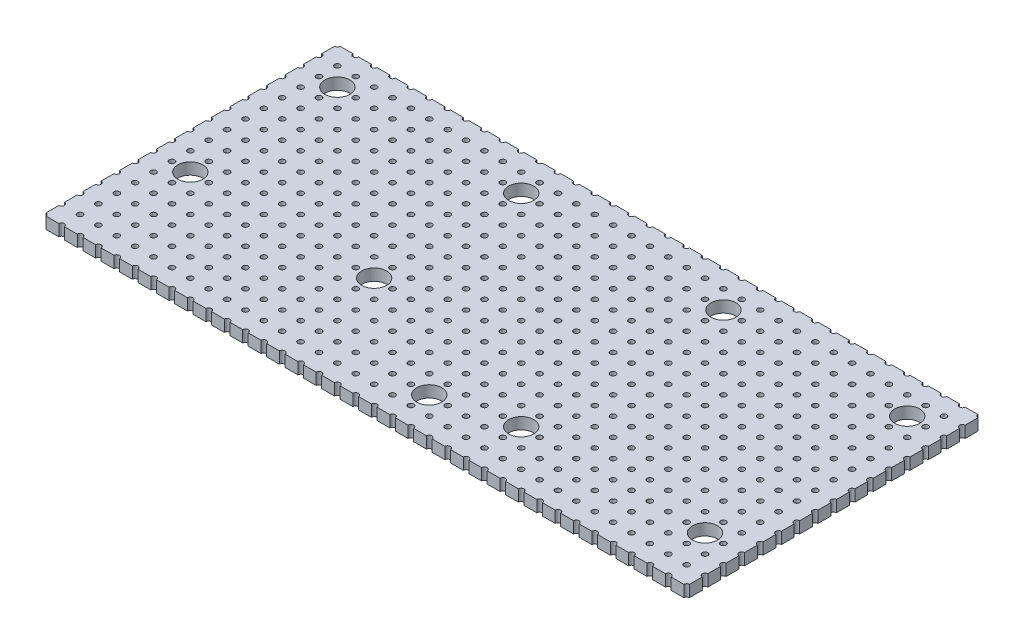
SolidWorks part; units mm, degrees
ref_plane "Front Plane" through (0, 0, 0) normal (0, 0, 1) x (1, 0, 0)
ref_plane "Top Plane" through (0, 0, 0) normal (0, 1, 0) x (1, 0, 0)
ref_plane "Right Plane" through (0, 0, 0) normal (1, 0, 0) x (0, 0, -1)
sketch "Sketch1" plane through (0, 0, 0) normal (0, 1, 0) x (1, 0, 0)
  line L1 (59.69, -39.37) -> (-59.69, -39.37)
  line L2 (59.69, -39.37) -> (59.69, 39.37)
  line L3 (59.69, 39.37) -> (-59.69, 39.37)
  line L4 (-59.69, -39.37) -> (-59.69, 39.37)
  line L5 (59.69, -39.37) -> (-59.69, 39.37) construction
  line L6 (59.69, 39.37) -> (-59.69, -39.37) construction
  point P0 (0, 0)
  dimension "D1" = 119.38
  dimension "D2" = 78.74
extrude "Boss-Extrude1" add sketch "Sketch1" along normal blind 1.6
sketch "Sketch2" plane through (0, 1.6, 0) normal (0, 1, 0) x (1, 0, 0)
  line L0 (-59.69, 39.37) -> (-59.69, -39.37) construction
  line L1 (59.69, 39.37) -> (-59.69, 39.37) construction
  circle A0 centre (-58.42, 38.1) radius 0.381
  circle A1 centre (-55.88, 38.1) radius 0.381
  circle A2 centre (-53.34, 38.1) radius 0.381
  circle A3 centre (-50.8, 38.1) radius 0.381
  circle A4 centre (-48.26, 38.1) radius 0.381
  circle A5 centre (-45.72, 38.1) radius 0.381
  circle A6 centre (-43.18, 38.1) radius 0.381
  circle A7 centre (-40.64, 38.1) radius 0.381
  circle A8 centre (-38.1, 38.1) radius 0.381
  circle A9 centre (-35.56, 38.1) radius 0.381
  circle A10 centre (-33.02, 38.1) radius 0.381
  circle A11 centre (-30.48, 38.1) radius 0.381
  circle A12 centre (-27.94, 38.1) radius 0.381
  circle A13 centre (-25.4, 38.1) radius 0.381
  circle A14 centre (-22.86, 38.1) radius 0.381
  circle A15 centre (-20.32, 38.1) radius 0.381
  circle A16 centre (-17.78, 38.1) radius 0.381
  circle A17 centre (-15.24, 38.1) radius 0.381
  circle A18 centre (-12.7, 38.1) radius 0.381
  circle A19 centre (-10.16, 38.1) radius 0.381
  circle A20 centre (-7.62, 38.1) radius 0.381
  circle A21 centre (-5.08, 38.1) radius 0.381
  circle A22 centre (-2.54, 38.1) radius 0.381
  circle A23 centre (0, 38.1) radius 0.381
  circle A24 centre (2.54, 38.1) radius 0.381
  circle A25 centre (5.08, 38.1) radius 0.381
  circle A26 centre (7.62, 38.1) radius 0.381
  circle A27 centre (10.16, 38.1) radius 0.381
  circle A28 centre (12.7, 38.1) radius 0.381
  circle A29 centre (15.24, 38.1) radius 0.381
  circle A30 centre (17.78, 38.1) radius 0.381
  circle A31 centre (20.32, 38.1) radius 0.381
  circle A32 centre (22.86, 38.1) radius 0.381
  circle A33 centre (25.4, 38.1) radius 0.381
  circle A34 centre (27.94, 38.1) radius 0.381
  circle A35 centre (30.48, 38.1) radius 0.381
  circle A36 centre (33.02, 38.1) radius 0.381
  circle A37 centre (35.56, 38.1) radius 0.381
  circle A38 centre (38.1, 38.1) radius 0.381
  circle A39 centre (40.64, 38.1) radius 0.381
  circle A40 centre (43.18, 38.1) radius 0.381
  circle A41 centre (45.72, 38.1) radius 0.381
  circle A42 centre (48.26, 38.1) radius 0.381
  circle A43 centre (50.8, 38.1) radius 0.381
  circle A44 centre (53.34, 38.1) radius 0.381
  circle A45 centre (55.88, 38.1) radius 0.381
  circle A46 centre (58.42, 38.1) radius 0.381
  circle A47 centre (-55.88, 35.56) radius 0.381
  circle A48 centre (-53.34, 35.56) radius 0.381
  circle A49 centre (-50.8, 35.56) radius 0.381
  circle A50 centre (-48.26, 35.56) radius 0.381
  circle A51 centre (-45.72, 35.56) radius 0.381
  circle A52 centre (-43.18, 35.56) radius 0.381
  circle A53 centre (-40.64, 35.56) radius 0.381
  circle A54 centre (-38.1, 35.56) radius 0.381
  circle A55 centre (-35.56, 35.56) radius 0.381
  circle A56 centre (-33.02, 35.56) radius 0.381
  circle A57 centre (-30.48, 35.56) radius 0.381
  circle A58 centre (-27.94, 35.56) radius 0.381
  circle A59 centre (-25.4, 35.56) radius 0.381
  circle A60 centre (-22.86, 35.56) radius 0.381
  circle A61 centre (-20.32, 35.56) radius 0.381
  circle A62 centre (-17.78, 35.56) radius 0.381
  circle A63 centre (-15.24, 35.56) radius 0.381
  circle A64 centre (-12.7, 35.56) radius 0.381
  circle A65 centre (-10.16, 35.56) radius 0.381
  circle A66 centre (-7.62, 35.56) radius 0.381
  circle A67 centre (-5.08, 35.56) radius 0.381
  circle A68 centre (-2.54, 35.56) radius 0.381
  circle A69 centre (0, 35.56) radius 0.381
  circle A70 centre (2.54, 35.56) radius 0.381
  circle A71 centre (5.08, 35.56) radius 0.381
  circle A72 centre (7.62, 35.56) radius 0.381
  circle A73 centre (10.16, 35.56) radius 0.381
  circle A74 centre (12.7, 35.56) radius 0.381
  circle A75 centre (15.24, 35.56) radius 0.381
  circle A76 centre (17.78, 35.56) radius 0.381
  circle A77 centre (20.32, 35.56) radius 0.381
  circle A78 centre (22.86, 35.56) radius 0.381
  circle A79 centre (25.4, 35.56) radius 0.381
  circle A80 centre (27.94, 35.56) radius 0.381
  circle A81 centre (30.48, 35.56) radius 0.381
  circle A82 centre (33.02, 35.56) radius 0.381
  circle A83 centre (35.56, 35.56) radius 0.381
  circle A84 centre (38.1, 35.56) radius 0.381
  circle A85 centre (40.64, 35.56) radius 0.381
  circle A86 centre (43.18, 35.56) radius 0.381
  circle A87 centre (45.72, 35.56) radius 0.381
  circle A88 centre (48.26, 35.56) radius 0.381
  circle A89 centre (50.8, 35.56) radius 0.381
  circle A90 centre (53.34, 35.56) radius 0.381
  circle A91 centre (55.88, 35.56) radius 0.381
  circle A92 centre (58.42, 35.56) radius 0.381
  circle A93 centre (-55.88, 33.02) radius 0.381
  circle A94 centre (-53.34, 33.02) radius 0.381
  circle A95 centre (-50.8, 33.02) radius 0.381
  circle A96 centre (-48.26, 33.02) radius 0.381
  circle A97 centre (-45.72, 33.02) radius 0.381
  circle A98 centre (-43.18, 33.02) radius 0.381
  circle A99 centre (-40.64, 33.02) radius 0.381
  circle A100 centre (-38.1, 33.02) radius 0.381
  circle A101 centre (-35.56, 33.02) radius 0.381
  circle A102 centre (-33.02, 33.02) radius 0.381
  circle A103 centre (-30.48, 33.02) radius 0.381
  circle A104 centre (-27.94, 33.02) radius 0.381
  circle A105 centre (-25.4, 33.02) radius 0.381
  circle A106 centre (-22.86, 33.02) radius 0.381
  circle A107 centre (-20.32, 33.02) radius 0.381
  circle A108 centre (-17.78, 33.02) radius 0.381
  circle A109 centre (-15.24, 33.02) radius 0.381
  circle A110 centre (-12.7, 33.02) radius 0.381
  circle A111 centre (-10.16, 33.02) radius 0.381
  circle A112 centre (-7.62, 33.02) radius 0.381
  circle A113 centre (-5.08, 33.02) radius 0.381
  circle A114 centre (-2.54, 33.02) radius 0.381
  circle A115 centre (0, 33.02) radius 0.381
  circle A116 centre (2.54, 33.02) radius 0.381
  circle A117 centre (5.08, 33.02) radius 0.381
  circle A118 centre (7.62, 33.02) radius 0.381
  circle A119 centre (10.16, 33.02) radius 0.381
  circle A120 centre (12.7, 33.02) radius 0.381
  circle A121 centre (15.24, 33.02) radius 0.381
  circle A122 centre (17.78, 33.02) radius 0.381
  circle A123 centre (20.32, 33.02) radius 0.381
  circle A124 centre (22.86, 33.02) radius 0.381
  circle A125 centre (25.4, 33.02) radius 0.381
  circle A126 centre (27.94, 33.02) radius 0.381
  circle A127 centre (30.48, 33.02) radius 0.381
  circle A128 centre (33.02, 33.02) radius 0.381
  circle A129 centre (35.56, 33.02) radius 0.381
  circle A130 centre (38.1, 33.02) radius 0.381
  circle A131 centre (40.64, 33.02) radius 0.381
  circle A132 centre (43.18, 33.02) radius 0.381
  circle A133 centre (45.72, 33.02) radius 0.381
  circle A134 centre (48.26, 33.02) radius 0.381
  circle A135 centre (50.8, 33.02) radius 0.381
  circle A136 centre (53.34, 33.02) radius 0.381
  circle A137 centre (55.88, 33.02) radius 0.381
  circle A138 centre (58.42, 33.02) radius 0.381
  circle A139 centre (-55.88, 30.48) radius 0.381
  circle A140 centre (-53.34, 30.48) radius 0.381
  circle A141 centre (-50.8, 30.48) radius 0.381
  circle A142 centre (-48.26, 30.48) radius 0.381
  circle A143 centre (-45.72, 30.48) radius 0.381
  circle A144 centre (-43.18, 30.48) radius 0.381
  circle A145 centre (-40.64, 30.48) radius 0.381
  circle A146 centre (-38.1, 30.48) radius 0.381
  circle A147 centre (-35.56, 30.48) radius 0.381
  circle A148 centre (-33.02, 30.48) radius 0.381
  circle A149 centre (-30.48, 30.48) radius 0.381
  circle A150 centre (-27.94, 30.48) radius 0.381
  circle A151 centre (-25.4, 30.48) radius 0.381
  circle A152 centre (-22.86, 30.48) radius 0.381
  circle A153 centre (-20.32, 30.48) radius 0.381
  circle A154 centre (-17.78, 30.48) radius 0.381
  circle A155 centre (-15.24, 30.48) radius 0.381
  circle A156 centre (-12.7, 30.48) radius 0.381
  circle A157 centre (-10.16, 30.48) radius 0.381
  circle A158 centre (-7.62, 30.48) radius 0.381
  circle A159 centre (-5.08, 30.48) radius 0.381
  circle A160 centre (-2.54, 30.48) radius 0.381
  circle A161 centre (0, 30.48) radius 0.381
  circle A162 centre (2.54, 30.48) radius 0.381
  circle A163 centre (5.08, 30.48) radius 0.381
  circle A164 centre (7.62, 30.48) radius 0.381
  circle A165 centre (10.16, 30.48) radius 0.381
  circle A166 centre (12.7, 30.48) radius 0.381
  circle A167 centre (15.24, 30.48) radius 0.381
  circle A168 centre (17.78, 30.48) radius 0.381
  circle A169 centre (20.32, 30.48) radius 0.381
  circle A170 centre (22.86, 30.48) radius 0.381
  circle A171 centre (25.4, 30.48) radius 0.381
  circle A172 centre (27.94, 30.48) radius 0.381
  circle A173 centre (30.48, 30.48) radius 0.381
  circle A174 centre (33.02, 30.48) radius 0.381
  circle A175 centre (35.56, 30.48) radius 0.381
  circle A176 centre (38.1, 30.48) radius 0.381
  circle A177 centre (40.64, 30.48) radius 0.381
  circle A178 centre (43.18, 30.48) radius 0.381
  circle A179 centre (45.72, 30.48) radius 0.381
  circle A180 centre (48.26, 30.48) radius 0.381
  circle A181 centre (50.8, 30.48) radius 0.381
  circle A182 centre (53.34, 30.48) radius 0.381
  circle A183 centre (55.88, 30.48) radius 0.381
  circle A184 centre (58.42, 30.48) radius 0.381
  circle A185 centre (-55.88, 27.94) radius 0.381
  circle A186 centre (-53.34, 27.94) radius 0.381
  circle A187 centre (-50.8, 27.94) radius 0.381
  circle A188 centre (-48.26, 27.94) radius 0.381
  circle A189 centre (-45.72, 27.94) radius 0.381
  circle A190 centre (-43.18, 27.94) radius 0.381
  circle A191 centre (-40.64, 27.94) radius 0.381
  circle A192 centre (-38.1, 27.94) radius 0.381
  circle A193 centre (-35.56, 27.94) radius 0.381
  circle A194 centre (-33.02, 27.94) radius 0.381
  circle A195 centre (-30.48, 27.94) radius 0.381
  circle A196 centre (-27.94, 27.94) radius 0.381
  circle A197 centre (-25.4, 27.94) radius 0.381
  circle A198 centre (-22.86, 27.94) radius 0.381
  circle A199 centre (-20.32, 27.94) radius 0.381
  circle A200 centre (-17.78, 27.94) radius 0.381
  circle A201 centre (-15.24, 27.94) radius 0.381
  circle A202 centre (-12.7, 27.94) radius 0.381
  circle A203 centre (-10.16, 27.94) radius 0.381
  circle A204 centre (-7.62, 27.94) radius 0.381
  circle A205 centre (-5.08, 27.94) radius 0.381
  circle A206 centre (-2.54, 27.94) radius 0.381
  circle A207 centre (0, 27.94) radius 0.381
  circle A208 centre (2.54, 27.94) radius 0.381
  circle A209 centre (5.08, 27.94) radius 0.381
  circle A210 centre (7.62, 27.94) radius 0.381
  circle A211 centre (10.16, 27.94) radius 0.381
  circle A212 centre (12.7, 27.94) radius 0.381
  circle A213 centre (15.24, 27.94) radius 0.381
  circle A214 centre (17.78, 27.94) radius 0.381
  circle A215 centre (20.32, 27.94) radius 0.381
  circle A216 centre (22.86, 27.94) radius 0.381
  circle A217 centre (25.4, 27.94) radius 0.381
  circle A218 centre (27.94, 27.94) radius 0.381
  circle A219 centre (30.48, 27.94) radius 0.381
  circle A220 centre (33.02, 27.94) radius 0.381
  circle A221 centre (35.56, 27.94) radius 0.381
  circle A222 centre (38.1, 27.94) radius 0.381
  circle A223 centre (40.64, 27.94) radius 0.381
  circle A224 centre (43.18, 27.94) radius 0.381
  circle A225 centre (45.72, 27.94) radius 0.381
  circle A226 centre (48.26, 27.94) radius 0.381
  circle A227 centre (50.8, 27.94) radius 0.381
  circle A228 centre (53.34, 27.94) radius 0.381
  circle A229 centre (55.88, 27.94) radius 0.381
  circle A230 centre (58.42, 27.94) radius 0.381
  circle A231 centre (-55.88, 25.4) radius 0.381
  circle A232 centre (-53.34, 25.4) radius 0.381
  circle A233 centre (-50.8, 25.4) radius 0.381
  circle A234 centre (-48.26, 25.4) radius 0.381
  circle A235 centre (-45.72, 25.4) radius 0.381
  circle A236 centre (-43.18, 25.4) radius 0.381
  circle A237 centre (-40.64, 25.4) radius 0.381
  circle A238 centre (-38.1, 25.4) radius 0.381
  circle A239 centre (-35.56, 25.4) radius 0.381
  circle A240 centre (-33.02, 25.4) radius 0.381
  circle A241 centre (-30.48, 25.4) radius 0.381
  circle A242 centre (-27.94, 25.4) radius 0.381
  circle A243 centre (-25.4, 25.4) radius 0.381
  circle A244 centre (-22.86, 25.4) radius 0.381
  circle A245 centre (-20.32, 25.4) radius 0.381
  circle A246 centre (-17.78, 25.4) radius 0.381
  circle A247 centre (-15.24, 25.4) radius 0.381
  circle A248 centre (-12.7, 25.4) radius 0.381
  circle A249 centre (-10.16, 25.4) radius 0.381
  circle A250 centre (-7.62, 25.4) radius 0.381
  circle A251 centre (-5.08, 25.4) radius 0.381
  circle A252 centre (-2.54, 25.4) radius 0.381
  circle A253 centre (0, 25.4) radius 0.381
  circle A254 centre (2.54, 25.4) radius 0.381
  circle A255 centre (5.08, 25.4) radius 0.381
  circle A256 centre (7.62, 25.4) radius 0.381
  circle A257 centre (10.16, 25.4) radius 0.381
  circle A258 centre (12.7, 25.4) radius 0.381
  circle A259 centre (15.24, 25.4) radius 0.381
  circle A260 centre (17.78, 25.4) radius 0.381
  circle A261 centre (20.32, 25.4) radius 0.381
  circle A262 centre (22.86, 25.4) radius 0.381
  circle A263 centre (25.4, 25.4) radius 0.381
  circle A264 centre (27.94, 25.4) radius 0.381
  circle A265 centre (30.48, 25.4) radius 0.381
  circle A266 centre (33.02, 25.4) radius 0.381
  circle A267 centre (35.56, 25.4) radius 0.381
  circle A268 centre (38.1, 25.4) radius 0.381
  circle A269 centre (40.64, 25.4) radius 0.381
  circle A270 centre (43.18, 25.4) radius 0.381
  circle A271 centre (45.72, 25.4) radius 0.381
  circle A272 centre (48.26, 25.4) radius 0.381
  circle A273 centre (50.8, 25.4) radius 0.381
  circle A274 centre (53.34, 25.4) radius 0.381
  circle A275 centre (55.88, 25.4) radius 0.381
  circle A276 centre (58.42, 25.4) radius 0.381
  circle A277 centre (-55.88, 22.86) radius 0.381
  circle A278 centre (-53.34, 22.86) radius 0.381
  circle A279 centre (-50.8, 22.86) radius 0.381
  circle A280 centre (-48.26, 22.86) radius 0.381
  circle A281 centre (-45.72, 22.86) radius 0.381
  circle A282 centre (-43.18, 22.86) radius 0.381
  circle A283 centre (-40.64, 22.86) radius 0.381
  circle A284 centre (-38.1, 22.86) radius 0.381
  circle A285 centre (-35.56, 22.86) radius 0.381
  circle A286 centre (-33.02, 22.86) radius 0.381
  circle A287 centre (-30.48, 22.86) radius 0.381
  circle A288 centre (-27.94, 22.86) radius 0.381
  circle A289 centre (-25.4, 22.86) radius 0.381
  circle A290 centre (-22.86, 22.86) radius 0.381
  circle A291 centre (-20.32, 22.86) radius 0.381
  circle A292 centre (-17.78, 22.86) radius 0.381
  circle A293 centre (-15.24, 22.86) radius 0.381
  circle A294 centre (-12.7, 22.86) radius 0.381
  circle A295 centre (-10.16, 22.86) radius 0.381
  circle A296 centre (-7.62, 22.86) radius 0.381
  circle A297 centre (-5.08, 22.86) radius 0.381
  circle A298 centre (-2.54, 22.86) radius 0.381
  circle A299 centre (0, 22.86) radius 0.381
  circle A300 centre (2.54, 22.86) radius 0.381
  circle A301 centre (5.08, 22.86) radius 0.381
  circle A302 centre (7.62, 22.86) radius 0.381
  circle A303 centre (10.16, 22.86) radius 0.381
  circle A304 centre (12.7, 22.86) radius 0.381
  circle A305 centre (15.24, 22.86) radius 0.381
  circle A306 centre (17.78, 22.86) radius 0.381
  circle A307 centre (20.32, 22.86) radius 0.381
  circle A308 centre (22.86, 22.86) radius 0.381
  circle A309 centre (25.4, 22.86) radius 0.381
  circle A310 centre (27.94, 22.86) radius 0.381
  circle A311 centre (30.48, 22.86) radius 0.381
  circle A312 centre (33.02, 22.86) radius 0.381
  circle A313 centre (35.56, 22.86) radius 0.381
  circle A314 centre (38.1, 22.86) radius 0.381
  circle A315 centre (40.64, 22.86) radius 0.381
  circle A316 centre (43.18, 22.86) radius 0.381
  circle A317 centre (45.72, 22.86) radius 0.381
  circle A318 centre (48.26, 22.86) radius 0.381
  circle A319 centre (50.8, 22.86) radius 0.381
  circle A320 centre (53.34, 22.86) radius 0.381
  circle A321 centre (55.88, 22.86) radius 0.381
  circle A322 centre (58.42, 22.86) radius 0.381
  circle A323 centre (-55.88, 20.32) radius 0.381
  circle A324 centre (-53.34, 20.32) radius 0.381
  circle A325 centre (-50.8, 20.32) radius 0.381
  circle A326 centre (-48.26, 20.32) radius 0.381
  circle A327 centre (-45.72, 20.32) radius 0.381
  circle A328 centre (-43.18, 20.32) radius 0.381
  circle A329 centre (-40.64, 20.32) radius 0.381
  circle A330 centre (-38.1, 20.32) radius 0.381
  circle A331 centre (-35.56, 20.32) radius 0.381
  circle A332 centre (-33.02, 20.32) radius 0.381
  circle A333 centre (-30.48, 20.32) radius 0.381
  circle A334 centre (-27.94, 20.32) radius 0.381
  circle A335 centre (-25.4, 20.32) radius 0.381
  circle A336 centre (-22.86, 20.32) radius 0.381
  circle A337 centre (-20.32, 20.32) radius 0.381
  circle A338 centre (-17.78, 20.32) radius 0.381
  circle A339 centre (-15.24, 20.32) radius 0.381
  circle A340 centre (-12.7, 20.32) radius 0.381
  circle A341 centre (-10.16, 20.32) radius 0.381
  circle A342 centre (-7.62, 20.32) radius 0.381
  circle A343 centre (-5.08, 20.32) radius 0.381
  circle A344 centre (-2.54, 20.32) radius 0.381
  circle A345 centre (0, 20.32) radius 0.381
  circle A346 centre (2.54, 20.32) radius 0.381
  circle A347 centre (5.08, 20.32) radius 0.381
  circle A348 centre (7.62, 20.32) radius 0.381
  circle A349 centre (10.16, 20.32) radius 0.381
  circle A350 centre (12.7, 20.32) radius 0.381
  circle A351 centre (15.24, 20.32) radius 0.381
  circle A352 centre (17.78, 20.32) radius 0.381
  circle A353 centre (20.32, 20.32) radius 0.381
  circle A354 centre (22.86, 20.32) radius 0.381
  circle A355 centre (25.4, 20.32) radius 0.381
  circle A356 centre (27.94, 20.32) radius 0.381
  circle A357 centre (30.48, 20.32) radius 0.381
  circle A358 centre (33.02, 20.32) radius 0.381
  circle A359 centre (35.56, 20.32) radius 0.381
  circle A360 centre (38.1, 20.32) radius 0.381
  circle A361 centre (40.64, 20.32) radius 0.381
  circle A362 centre (43.18, 20.32) radius 0.381
  circle A363 centre (45.72, 20.32) radius 0.381
  circle A364 centre (48.26, 20.32) radius 0.381
  circle A365 centre (50.8, 20.32) radius 0.381
  circle A366 centre (53.34, 20.32) radius 0.381
  circle A367 centre (55.88, 20.32) radius 0.381
  circle A368 centre (58.42, 20.32) radius 0.381
  circle A369 centre (-55.88, 17.78) radius 0.381
  circle A370 centre (-53.34, 17.78) radius 0.381
  circle A371 centre (-50.8, 17.78) radius 0.381
  circle A372 centre (-48.26, 17.78) radius 0.381
  circle A373 centre (-45.72, 17.78) radius 0.381
  circle A374 centre (-43.18, 17.78) radius 0.381
  circle A375 centre (-40.64, 17.78) radius 0.381
  circle A376 centre (-38.1, 17.78) radius 0.381
  circle A377 centre (-35.56, 17.78) radius 0.381
  circle A378 centre (-33.02, 17.78) radius 0.381
  circle A379 centre (-30.48, 17.78) radius 0.381
  circle A380 centre (-27.94, 17.78) radius 0.381
  circle A381 centre (-25.4, 17.78) radius 0.381
  circle A382 centre (-22.86, 17.78) radius 0.381
  circle A383 centre (-20.32, 17.78) radius 0.381
  circle A384 centre (-17.78, 17.78) radius 0.381
  circle A385 centre (-15.24, 17.78) radius 0.381
  circle A386 centre (-12.7, 17.78) radius 0.381
  circle A387 centre (-10.16, 17.78) radius 0.381
  circle A388 centre (-7.62, 17.78) radius 0.381
  circle A389 centre (-5.08, 17.78) radius 0.381
  circle A390 centre (-2.54, 17.78) radius 0.381
  circle A391 centre (0, 17.78) radius 0.381
  circle A392 centre (2.54, 17.78) radius 0.381
  circle A393 centre (5.08, 17.78) radius 0.381
  circle A394 centre (7.62, 17.78) radius 0.381
  circle A395 centre (10.16, 17.78) radius 0.381
  circle A396 centre (12.7, 17.78) radius 0.381
  circle A397 centre (15.24, 17.78) radius 0.381
  circle A398 centre (17.78, 17.78) radius 0.381
  circle A399 centre (20.32, 17.78) radius 0.381
  circle A400 centre (22.86, 17.78) radius 0.381
  circle A401 centre (25.4, 17.78) radius 0.381
  circle A402 centre (27.94, 17.78) radius 0.381
  circle A403 centre (30.48, 17.78) radius 0.381
  circle A404 centre (33.02, 17.78) radius 0.381
  circle A405 centre (35.56, 17.78) radius 0.381
  circle A406 centre (38.1, 17.78) radius 0.381
  circle A407 centre (40.64, 17.78) radius 0.381
  circle A408 centre (43.18, 17.78) radius 0.381
  circle A409 centre (45.72, 17.78) radius 0.381
  circle A410 centre (48.26, 17.78) radius 0.381
  circle A411 centre (50.8, 17.78) radius 0.381
  circle A412 centre (53.34, 17.78) radius 0.381
  circle A413 centre (55.88, 17.78) radius 0.381
  circle A414 centre (58.42, 17.78) radius 0.381
  circle A415 centre (-55.88, 15.24) radius 0.381
  circle A416 centre (-53.34, 15.24) radius 0.381
  circle A417 centre (-50.8, 15.24) radius 0.381
  circle A418 centre (-48.26, 15.24) radius 0.381
  circle A419 centre (-45.72, 15.24) radius 0.381
  circle A420 centre (-43.18, 15.24) radius 0.381
  circle A421 centre (-40.64, 15.24) radius 0.381
  circle A422 centre (-38.1, 15.24) radius 0.381
  circle A423 centre (-35.56, 15.24) radius 0.381
  circle A424 centre (-33.02, 15.24) radius 0.381
  circle A425 centre (-30.48, 15.24) radius 0.381
  circle A426 centre (-27.94, 15.24) radius 0.381
  circle A427 centre (-25.4, 15.24) radius 0.381
  circle A428 centre (-22.86, 15.24) radius 0.381
  circle A429 centre (-20.32, 15.24) radius 0.381
  circle A430 centre (-17.78, 15.24) radius 0.381
  circle A431 centre (-15.24, 15.24) radius 0.381
  circle A432 centre (-12.7, 15.24) radius 0.381
  circle A433 centre (-10.16, 15.24) radius 0.381
  circle A434 centre (-7.62, 15.24) radius 0.381
  circle A435 centre (-5.08, 15.24) radius 0.381
  circle A436 centre (-2.54, 15.24) radius 0.381
  circle A437 centre (0, 15.24) radius 0.381
  circle A438 centre (2.54, 15.24) radius 0.381
  circle A439 centre (5.08, 15.24) radius 0.381
  circle A440 centre (7.62, 15.24) radius 0.381
  circle A441 centre (10.16, 15.24) radius 0.381
  circle A442 centre (12.7, 15.24) radius 0.381
  circle A443 centre (15.24, 15.24) radius 0.381
  circle A444 centre (17.78, 15.24) radius 0.381
  circle A445 centre (20.32, 15.24) radius 0.381
  circle A446 centre (22.86, 15.24) radius 0.381
  circle A447 centre (25.4, 15.24) radius 0.381
  circle A448 centre (27.94, 15.24) radius 0.381
  circle A449 centre (30.48, 15.24) radius 0.381
  circle A450 centre (33.02, 15.24) radius 0.381
  circle A451 centre (35.56, 15.24) radius 0.381
  circle A452 centre (38.1, 15.24) radius 0.381
  circle A453 centre (40.64, 15.24) radius 0.381
  circle A454 centre (43.18, 15.24) radius 0.381
  circle A455 centre (45.72, 15.24) radius 0.381
  circle A456 centre (48.26, 15.24) radius 0.381
  circle A457 centre (50.8, 15.24) radius 0.381
  circle A458 centre (53.34, 15.24) radius 0.381
  circle A459 centre (55.88, 15.24) radius 0.381
  circle A460 centre (58.42, 15.24) radius 0.381
  circle A461 centre (-55.88, 12.7) radius 0.381
  circle A462 centre (-53.34, 12.7) radius 0.381
  circle A463 centre (-50.8, 12.7) radius 0.381
  circle A464 centre (-48.26, 12.7) radius 0.381
  circle A465 centre (-45.72, 12.7) radius 0.381
  circle A466 centre (-43.18, 12.7) radius 0.381
  circle A467 centre (-40.64, 12.7) radius 0.381
  circle A468 centre (-38.1, 12.7) radius 0.381
  circle A469 centre (-35.56, 12.7) radius 0.381
  circle A470 centre (-33.02, 12.7) radius 0.381
  circle A471 centre (-30.48, 12.7) radius 0.381
  circle A472 centre (-27.94, 12.7) radius 0.381
  circle A473 centre (-25.4, 12.7) radius 0.381
  circle A474 centre (-22.86, 12.7) radius 0.381
  circle A475 centre (-20.32, 12.7) radius 0.381
  circle A476 centre (-17.78, 12.7) radius 0.381
  circle A477 centre (-15.24, 12.7) radius 0.381
  circle A478 centre (-12.7, 12.7) radius 0.381
  circle A479 centre (-10.16, 12.7) radius 0.381
  circle A480 centre (-7.62, 12.7) radius 0.381
  circle A481 centre (-5.08, 12.7) radius 0.381
  circle A482 centre (-2.54, 12.7) radius 0.381
  circle A483 centre (0, 12.7) radius 0.381
  circle A484 centre (2.54, 12.7) radius 0.381
  circle A485 centre (5.08, 12.7) radius 0.381
  circle A486 centre (7.62, 12.7) radius 0.381
  circle A487 centre (10.16, 12.7) radius 0.381
  circle A488 centre (12.7, 12.7) radius 0.381
  circle A489 centre (15.24, 12.7) radius 0.381
  circle A490 centre (17.78, 12.7) radius 0.381
  circle A491 centre (20.32, 12.7) radius 0.381
  circle A492 centre (22.86, 12.7) radius 0.381
  circle A493 centre (25.4, 12.7) radius 0.381
  circle A494 centre (27.94, 12.7) radius 0.381
  circle A495 centre (30.48, 12.7) radius 0.381
  circle A496 centre (33.02, 12.7) radius 0.381
  circle A497 centre (35.56, 12.7) radius 0.381
  circle A498 centre (38.1, 12.7) radius 0.381
  circle A499 centre (40.64, 12.7) radius 0.381
  circle A500 centre (43.18, 12.7) radius 0.381
  circle A501 centre (45.72, 12.7) radius 0.381
  circle A502 centre (48.26, 12.7) radius 0.381
  circle A503 centre (50.8, 12.7) radius 0.381
  circle A504 centre (53.34, 12.7) radius 0.381
  circle A505 centre (55.88, 12.7) radius 0.381
  circle A506 centre (58.42, 12.7) radius 0.381
  circle A507 centre (-55.88, 10.16) radius 0.381
  circle A508 centre (-53.34, 10.16) radius 0.381
  circle A509 centre (-50.8, 10.16) radius 0.381
  circle A510 centre (-48.26, 10.16) radius 0.381
  circle A511 centre (-45.72, 10.16) radius 0.381
  circle A512 centre (-43.18, 10.16) radius 0.381
  circle A513 centre (-40.64, 10.16) radius 0.381
  circle A514 centre (-38.1, 10.16) radius 0.381
  circle A515 centre (-35.56, 10.16) radius 0.381
  circle A516 centre (-33.02, 10.16) radius 0.381
  circle A517 centre (-30.48, 10.16) radius 0.381
  circle A518 centre (-27.94, 10.16) radius 0.381
  circle A519 centre (-25.4, 10.16) radius 0.381
  circle A520 centre (-22.86, 10.16) radius 0.381
  circle A521 centre (-20.32, 10.16) radius 0.381
  circle A522 centre (-17.78, 10.16) radius 0.381
  circle A523 centre (-15.24, 10.16) radius 0.381
  circle A524 centre (-12.7, 10.16) radius 0.381
  circle A525 centre (-10.16, 10.16) radius 0.381
  circle A526 centre (-7.62, 10.16) radius 0.381
  circle A527 centre (-5.08, 10.16) radius 0.381
  circle A528 centre (-2.54, 10.16) radius 0.381
  circle A529 centre (0, 10.16) radius 0.381
  circle A530 centre (2.54, 10.16) radius 0.381
  circle A531 centre (5.08, 10.16) radius 0.381
  circle A532 centre (7.62, 10.16) radius 0.381
  circle A533 centre (10.16, 10.16) radius 0.381
  circle A534 centre (12.7, 10.16) radius 0.381
  circle A535 centre (15.24, 10.16) radius 0.381
  circle A536 centre (17.78, 10.16) radius 0.381
  circle A537 centre (20.32, 10.16) radius 0.381
  circle A538 centre (22.86, 10.16) radius 0.381
  circle A539 centre (25.4, 10.16) radius 0.381
  circle A540 centre (27.94, 10.16) radius 0.381
  circle A541 centre (30.48, 10.16) radius 0.381
  circle A542 centre (33.02, 10.16) radius 0.381
  circle A543 centre (35.56, 10.16) radius 0.381
  circle A544 centre (38.1, 10.16) radius 0.381
  circle A545 centre (40.64, 10.16) radius 0.381
  circle A546 centre (43.18, 10.16) radius 0.381
  circle A547 centre (45.72, 10.16) radius 0.381
  circle A548 centre (48.26, 10.16) radius 0.381
  circle A549 centre (50.8, 10.16) radius 0.381
  circle A550 centre (53.34, 10.16) radius 0.381
  circle A551 centre (55.88, 10.16) radius 0.381
  circle A552 centre (58.42, 10.16) radius 0.381
  circle A553 centre (-55.88, 7.62) radius 0.381
  circle A554 centre (-53.34, 7.62) radius 0.381
  circle A555 centre (-50.8, 7.62) radius 0.381
  circle A556 centre (-48.26, 7.62) radius 0.381
  circle A557 centre (-45.72, 7.62) radius 0.381
  circle A558 centre (-43.18, 7.62) radius 0.381
  circle A559 centre (-40.64, 7.62) radius 0.381
  circle A560 centre (-38.1, 7.62) radius 0.381
  circle A561 centre (-35.56, 7.62) radius 0.381
  circle A562 centre (-33.02, 7.62) radius 0.381
  circle A563 centre (-30.48, 7.62) radius 0.381
  circle A564 centre (-27.94, 7.62) radius 0.381
  circle A565 centre (-25.4, 7.62) radius 0.381
  circle A566 centre (-22.86, 7.62) radius 0.381
  circle A567 centre (-20.32, 7.62) radius 0.381
  circle A568 centre (-17.78, 7.62) radius 0.381
  circle A569 centre (-15.24, 7.62) radius 0.381
  circle A570 centre (-12.7, 7.62) radius 0.381
  circle A571 centre (-10.16, 7.62) radius 0.381
  circle A572 centre (-7.62, 7.62) radius 0.381
  circle A573 centre (-5.08, 7.62) radius 0.381
  circle A574 centre (-2.54, 7.62) radius 0.381
  circle A575 centre (0, 7.62) radius 0.381
  circle A576 centre (2.54, 7.62) radius 0.381
  circle A577 centre (5.08, 7.62) radius 0.381
  circle A578 centre (7.62, 7.62) radius 0.381
  circle A579 centre (10.16, 7.62) radius 0.381
  circle A580 centre (12.7, 7.62) radius 0.381
  circle A581 centre (15.24, 7.62) radius 0.381
  circle A582 centre (17.78, 7.62) radius 0.381
  circle A583 centre (20.32, 7.62) radius 0.381
  circle A584 centre (22.86, 7.62) radius 0.381
  circle A585 centre (25.4, 7.62) radius 0.381
  circle A586 centre (27.94, 7.62) radius 0.381
  circle A587 centre (30.48, 7.62) radius 0.381
  circle A588 centre (33.02, 7.62) radius 0.381
  circle A589 centre (35.56, 7.62) radius 0.381
  circle A590 centre (38.1, 7.62) radius 0.381
  circle A591 centre (40.64, 7.62) radius 0.381
  circle A592 centre (43.18, 7.62) radius 0.381
  circle A593 centre (45.72, 7.62) radius 0.381
  circle A594 centre (48.26, 7.62) radius 0.381
  circle A595 centre (50.8, 7.62) radius 0.381
  circle A596 centre (53.34, 7.62) radius 0.381
  circle A597 centre (55.88, 7.62) radius 0.381
  circle A598 centre (58.42, 7.62) radius 0.381
  circle A599 centre (-55.88, 5.08) radius 0.381
  circle A600 centre (-53.34, 5.08) radius 0.381
  circle A601 centre (-50.8, 5.08) radius 0.381
  circle A602 centre (-48.26, 5.08) radius 0.381
  circle A603 centre (-45.72, 5.08) radius 0.381
  circle A604 centre (-43.18, 5.08) radius 0.381
  circle A605 centre (-40.64, 5.08) radius 0.381
  circle A606 centre (-38.1, 5.08) radius 0.381
  circle A607 centre (-35.56, 5.08) radius 0.381
  circle A608 centre (-33.02, 5.08) radius 0.381
  circle A609 centre (-30.48, 5.08) radius 0.381
  circle A610 centre (-27.94, 5.08) radius 0.381
  circle A611 centre (-25.4, 5.08) radius 0.381
  circle A612 centre (-22.86, 5.08) radius 0.381
  circle A613 centre (-20.32, 5.08) radius 0.381
  circle A614 centre (-17.78, 5.08) radius 0.381
  circle A615 centre (-15.24, 5.08) radius 0.381
  circle A616 centre (-12.7, 5.08) radius 0.381
  circle A617 centre (-10.16, 5.08) radius 0.381
  circle A618 centre (-7.62, 5.08) radius 0.381
  circle A619 centre (-5.08, 5.08) radius 0.381
  circle A620 centre (-2.54, 5.08) radius 0.381
  circle A621 centre (0, 5.08) radius 0.381
  circle A622 centre (2.54, 5.08) radius 0.381
  circle A623 centre (5.08, 5.08) radius 0.381
  circle A624 centre (7.62, 5.08) radius 0.381
  circle A625 centre (10.16, 5.08) radius 0.381
  circle A626 centre (12.7, 5.08) radius 0.381
  circle A627 centre (15.24, 5.08) radius 0.381
  circle A628 centre (17.78, 5.08) radius 0.381
  circle A629 centre (20.32, 5.08) radius 0.381
  circle A630 centre (22.86, 5.08) radius 0.381
  circle A631 centre (25.4, 5.08) radius 0.381
  circle A632 centre (27.94, 5.08) radius 0.381
  circle A633 centre (30.48, 5.08) radius 0.381
  circle A634 centre (33.02, 5.08) radius 0.381
  circle A635 centre (35.56, 5.08) radius 0.381
  circle A636 centre (38.1, 5.08) radius 0.381
  circle A637 centre (40.64, 5.08) radius 0.381
  circle A638 centre (43.18, 5.08) radius 0.381
  circle A639 centre (45.72, 5.08) radius 0.381
  circle A640 centre (48.26, 5.08) radius 0.381
  circle A641 centre (50.8, 5.08) radius 0.381
  circle A642 centre (53.34, 5.08) radius 0.381
  circle A643 centre (55.88, 5.08) radius 0.381
  circle A644 centre (58.42, 5.08) radius 0.381
  circle A645 centre (-55.88, 2.54) radius 0.381
  circle A646 centre (-53.34, 2.54) radius 0.381
  circle A647 centre (-50.8, 2.54) radius 0.381
  circle A648 centre (-48.26, 2.54) radius 0.381
  circle A649 centre (-45.72, 2.54) radius 0.381
  circle A650 centre (-43.18, 2.54) radius 0.381
  circle A651 centre (-40.64, 2.54) radius 0.381
  circle A652 centre (-38.1, 2.54) radius 0.381
  circle A653 centre (-35.56, 2.54) radius 0.381
  circle A654 centre (-33.02, 2.54) radius 0.381
  circle A655 centre (-30.48, 2.54) radius 0.381
  circle A656 centre (-27.94, 2.54) radius 0.381
  circle A657 centre (-25.4, 2.54) radius 0.381
  circle A658 centre (-22.86, 2.54) radius 0.381
  circle A659 centre (-20.32, 2.54) radius 0.381
  circle A660 centre (-17.78, 2.54) radius 0.381
  circle A661 centre (-15.24, 2.54) radius 0.381
  circle A662 centre (-12.7, 2.54) radius 0.381
  circle A663 centre (-10.16, 2.54) radius 0.381
  circle A664 centre (-7.62, 2.54) radius 0.381
  circle A665 centre (-5.08, 2.54) radius 0.381
  circle A666 centre (-2.54, 2.54) radius 0.381
  circle A667 centre (0, 2.54) radius 0.381
  circle A668 centre (2.54, 2.54) radius 0.381
  circle A669 centre (5.08, 2.54) radius 0.381
  circle A670 centre (7.62, 2.54) radius 0.381
  circle A671 centre (10.16, 2.54) radius 0.381
  circle A672 centre (12.7, 2.54) radius 0.381
  circle A673 centre (15.24, 2.54) radius 0.381
  circle A674 centre (17.78, 2.54) radius 0.381
  circle A675 centre (20.32, 2.54) radius 0.381
  circle A676 centre (22.86, 2.54) radius 0.381
  circle A677 centre (25.4, 2.54) radius 0.381
  circle A678 centre (27.94, 2.54) radius 0.381
  circle A679 centre (30.48, 2.54) radius 0.381
  circle A680 centre (33.02, 2.54) radius 0.381
  circle A681 centre (35.56, 2.54) radius 0.381
  circle A682 centre (38.1, 2.54) radius 0.381
  circle A683 centre (40.64, 2.54) radius 0.381
  circle A684 centre (43.18, 2.54) radius 0.381
  circle A685 centre (45.72, 2.54) radius 0.381
  circle A686 centre (48.26, 2.54) radius 0.381
  circle A687 centre (50.8, 2.54) radius 0.381
  circle A688 centre (53.34, 2.54) radius 0.381
  circle A689 centre (55.88, 2.54) radius 0.381
  circle A690 centre (58.42, 2.54) radius 0.381
  circle A691 centre (-55.88, 0) radius 0.381
  circle A692 centre (-53.34, 0) radius 0.381
  circle A693 centre (-50.8, 0) radius 0.381
  circle A694 centre (-48.26, 0) radius 0.381
  circle A695 centre (-45.72, 0) radius 0.381
  circle A696 centre (-43.18, 0) radius 0.381
  circle A697 centre (-40.64, 0) radius 0.381
  circle A698 centre (-38.1, 0) radius 0.381
  circle A699 centre (-35.56, 0) radius 0.381
  circle A700 centre (-33.02, 0) radius 0.381
  circle A701 centre (-30.48, 0) radius 0.381
  circle A702 centre (-27.94, 0) radius 0.381
  circle A703 centre (-25.4, 0) radius 0.381
  circle A704 centre (-22.86, 0) radius 0.381
  circle A705 centre (-20.32, 0) radius 0.381
  circle A706 centre (-17.78, 0) radius 0.381
  circle A707 centre (-15.24, 0) radius 0.381
  circle A708 centre (-12.7, 0) radius 0.381
  circle A709 centre (-10.16, 0) radius 0.381
  circle A710 centre (-7.62, 0) radius 0.381
  circle A711 centre (-5.08, 0) radius 0.381
  circle A712 centre (-2.54, 0) radius 0.381
  circle A713 centre (0, 0) radius 0.381
  circle A714 centre (2.54, 0) radius 0.381
  circle A715 centre (5.08, 0) radius 0.381
  circle A716 centre (7.62, 0) radius 0.381
  circle A717 centre (10.16, 0) radius 0.381
  circle A718 centre (12.7, 0) radius 0.381
  circle A719 centre (15.24, 0) radius 0.381
  circle A720 centre (17.78, 0) radius 0.381
  circle A721 centre (20.32, 0) radius 0.381
  circle A722 centre (22.86, 0) radius 0.381
  circle A723 centre (25.4, 0) radius 0.381
  circle A724 centre (27.94, 0) radius 0.381
  circle A725 centre (30.48, 0) radius 0.381
  circle A726 centre (33.02, 0) radius 0.381
  circle A727 centre (35.56, 0) radius 0.381
  circle A728 centre (38.1, 0) radius 0.381
  circle A729 centre (40.64, 0) radius 0.381
  circle A730 centre (43.18, 0) radius 0.381
  circle A731 centre (45.72, 0) radius 0.381
  circle A732 centre (48.26, 0) radius 0.381
  circle A733 centre (50.8, 0) radius 0.381
  circle A734 centre (53.34, 0) radius 0.381
  circle A735 centre (55.88, 0) radius 0.381
  circle A736 centre (58.42, 0) radius 0.381
  circle A737 centre (-55.88, -2.54) radius 0.381
  circle A738 centre (-53.34, -2.54) radius 0.381
  circle A739 centre (-50.8, -2.54) radius 0.381
  circle A740 centre (-48.26, -2.54) radius 0.381
  circle A741 centre (-45.72, -2.54) radius 0.381
  circle A742 centre (-43.18, -2.54) radius 0.381
  circle A743 centre (-40.64, -2.54) radius 0.381
  circle A744 centre (-38.1, -2.54) radius 0.381
  circle A745 centre (-35.56, -2.54) radius 0.381
  circle A746 centre (-33.02, -2.54) radius 0.381
  circle A747 centre (-30.48, -2.54) radius 0.381
  circle A748 centre (-27.94, -2.54) radius 0.381
  circle A749 centre (-25.4, -2.54) radius 0.381
  circle A750 centre (-22.86, -2.54) radius 0.381
  circle A751 centre (-20.32, -2.54) radius 0.381
  circle A752 centre (-17.78, -2.54) radius 0.381
  circle A753 centre (-15.24, -2.54) radius 0.381
  circle A754 centre (-12.7, -2.54) radius 0.381
  circle A755 centre (-10.16, -2.54) radius 0.381
  circle A756 centre (-7.62, -2.54) radius 0.381
  circle A757 centre (-5.08, -2.54) radius 0.381
  circle A758 centre (-2.54, -2.54) radius 0.381
  circle A759 centre (0, -2.54) radius 0.381
  circle A760 centre (2.54, -2.54) radius 0.381
  circle A761 centre (5.08, -2.54) radius 0.381
  circle A762 centre (7.62, -2.54) radius 0.381
  circle A763 centre (10.16, -2.54) radius 0.381
  circle A764 centre (12.7, -2.54) radius 0.381
  circle A765 centre (15.24, -2.54) radius 0.381
  circle A766 centre (17.78, -2.54) radius 0.381
  circle A767 centre (20.32, -2.54) radius 0.381
  circle A768 centre (22.86, -2.54) radius 0.381
  circle A769 centre (25.4, -2.54) radius 0.381
  circle A770 centre (27.94, -2.54) radius 0.381
  circle A771 centre (30.48, -2.54) radius 0.381
  circle A772 centre (33.02, -2.54) radius 0.381
  circle A773 centre (35.56, -2.54) radius 0.381
  circle A774 centre (38.1, -2.54) radius 0.381
  circle A775 centre (40.64, -2.54) radius 0.381
  circle A776 centre (43.18, -2.54) radius 0.381
  circle A777 centre (45.72, -2.54) radius 0.381
  circle A778 centre (48.26, -2.54) radius 0.381
  circle A779 centre (50.8, -2.54) radius 0.381
  circle A780 centre (53.34, -2.54) radius 0.381
  circle A781 centre (55.88, -2.54) radius 0.381
  circle A782 centre (58.42, -2.54) radius 0.381
  circle A783 centre (-55.88, -5.08) radius 0.381
  circle A784 centre (-53.34, -5.08) radius 0.381
  circle A785 centre (-50.8, -5.08) radius 0.381
  circle A786 centre (-48.26, -5.08) radius 0.381
  circle A787 centre (-45.72, -5.08) radius 0.381
  circle A788 centre (-43.18, -5.08) radius 0.381
  circle A789 centre (-40.64, -5.08) radius 0.381
  circle A790 centre (-38.1, -5.08) radius 0.381
  circle A791 centre (-35.56, -5.08) radius 0.381
  circle A792 centre (-33.02, -5.08) radius 0.381
  circle A793 centre (-30.48, -5.08) radius 0.381
  circle A794 centre (-27.94, -5.08) radius 0.381
  circle A795 centre (-25.4, -5.08) radius 0.381
  circle A796 centre (-22.86, -5.08) radius 0.381
  circle A797 centre (-20.32, -5.08) radius 0.381
  circle A798 centre (-17.78, -5.08) radius 0.381
  circle A799 centre (-15.24, -5.08) radius 0.381
  circle A800 centre (-12.7, -5.08) radius 0.381
  circle A801 centre (-10.16, -5.08) radius 0.381
  circle A802 centre (-7.62, -5.08) radius 0.381
  circle A803 centre (-5.08, -5.08) radius 0.381
  circle A804 centre (-2.54, -5.08) radius 0.381
  circle A805 centre (0, -5.08) radius 0.381
  circle A806 centre (2.54, -5.08) radius 0.381
  circle A807 centre (5.08, -5.08) radius 0.381
  circle A808 centre (7.62, -5.08) radius 0.381
  circle A809 centre (10.16, -5.08) radius 0.381
  circle A810 centre (12.7, -5.08) radius 0.381
  circle A811 centre (15.24, -5.08) radius 0.381
  circle A812 centre (17.78, -5.08) radius 0.381
  circle A813 centre (20.32, -5.08) radius 0.381
  circle A814 centre (22.86, -5.08) radius 0.381
  circle A815 centre (25.4, -5.08) radius 0.381
  circle A816 centre (27.94, -5.08) radius 0.381
  circle A817 centre (30.48, -5.08) radius 0.381
  circle A818 centre (33.02, -5.08) radius 0.381
  circle A819 centre (35.56, -5.08) radius 0.381
  circle A820 centre (38.1, -5.08) radius 0.381
  circle A821 centre (40.64, -5.08) radius 0.381
  circle A822 centre (43.18, -5.08) radius 0.381
  circle A823 centre (45.72, -5.08) radius 0.381
  circle A824 centre (48.26, -5.08) radius 0.381
  circle A825 centre (50.8, -5.08) radius 0.381
  circle A826 centre (53.34, -5.08) radius 0.381
  circle A827 centre (55.88, -5.08) radius 0.381
  circle A828 centre (58.42, -5.08) radius 0.381
  circle A829 centre (-55.88, -7.62) radius 0.381
  circle A830 centre (-53.34, -7.62) radius 0.381
  circle A831 centre (-50.8, -7.62) radius 0.381
  circle A832 centre (-48.26, -7.62) radius 0.381
  circle A833 centre (-45.72, -7.62) radius 0.381
  circle A834 centre (-43.18, -7.62) radius 0.381
  circle A835 centre (-40.64, -7.62) radius 0.381
  circle A836 centre (-38.1, -7.62) radius 0.381
  circle A837 centre (-35.56, -7.62) radius 0.381
  circle A838 centre (-33.02, -7.62) radius 0.381
  circle A839 centre (-30.48, -7.62) radius 0.381
  circle A840 centre (-27.94, -7.62) radius 0.381
  circle A841 centre (-25.4, -7.62) radius 0.381
  circle A842 centre (-22.86, -7.62) radius 0.381
  circle A843 centre (-20.32, -7.62) radius 0.381
  circle A844 centre (-17.78, -7.62) radius 0.381
  circle A845 centre (-15.24, -7.62) radius 0.381
  circle A846 centre (-12.7, -7.62) radius 0.381
  circle A847 centre (-10.16, -7.62) radius 0.381
  circle A848 centre (-7.62, -7.62) radius 0.381
  circle A849 centre (-5.08, -7.62) radius 0.381
  circle A850 centre (-2.54, -7.62) radius 0.381
  circle A851 centre (0, -7.62) radius 0.381
  circle A852 centre (2.54, -7.62) radius 0.381
  circle A853 centre (5.08, -7.62) radius 0.381
  circle A854 centre (7.62, -7.62) radius 0.381
  circle A855 centre (10.16, -7.62) radius 0.381
  circle A856 centre (12.7, -7.62) radius 0.381
  circle A857 centre (15.24, -7.62) radius 0.381
  circle A858 centre (17.78, -7.62) radius 0.381
  circle A859 centre (20.32, -7.62) radius 0.381
  circle A860 centre (22.86, -7.62) radius 0.381
  circle A861 centre (25.4, -7.62) radius 0.381
  circle A862 centre (27.94, -7.62) radius 0.381
  circle A863 centre (30.48, -7.62) radius 0.381
  circle A864 centre (33.02, -7.62) radius 0.381
  circle A865 centre (35.56, -7.62) radius 0.381
  circle A866 centre (38.1, -7.62) radius 0.381
  circle A867 centre (40.64, -7.62) radius 0.381
  circle A868 centre (43.18, -7.62) radius 0.381
  circle A869 centre (45.72, -7.62) radius 0.381
  circle A870 centre (48.26, -7.62) radius 0.381
  circle A871 centre (50.8, -7.62) radius 0.381
  circle A872 centre (53.34, -7.62) radius 0.381
  circle A873 centre (55.88, -7.62) radius 0.381
  circle A874 centre (58.42, -7.62) radius 0.381
  circle A875 centre (-55.88, -10.16) radius 0.381
  circle A876 centre (-53.34, -10.16) radius 0.381
  circle A877 centre (-50.8, -10.16) radius 0.381
  circle A878 centre (-48.26, -10.16) radius 0.381
  circle A879 centre (-45.72, -10.16) radius 0.381
  circle A880 centre (-43.18, -10.16) radius 0.381
  circle A881 centre (-40.64, -10.16) radius 0.381
  circle A882 centre (-38.1, -10.16) radius 0.381
  circle A883 centre (-35.56, -10.16) radius 0.381
  circle A884 centre (-33.02, -10.16) radius 0.381
  circle A885 centre (-30.48, -10.16) radius 0.381
  circle A886 centre (-27.94, -10.16) radius 0.381
  circle A887 centre (-25.4, -10.16) radius 0.381
  circle A888 centre (-22.86, -10.16) radius 0.381
  circle A889 centre (-20.32, -10.16) radius 0.381
  circle A890 centre (-17.78, -10.16) radius 0.381
  circle A891 centre (-15.24, -10.16) radius 0.381
  circle A892 centre (-12.7, -10.16) radius 0.381
  circle A893 centre (-10.16, -10.16) radius 0.381
  circle A894 centre (-7.62, -10.16) radius 0.381
  circle A895 centre (-5.08, -10.16) radius 0.381
  circle A896 centre (-2.54, -10.16) radius 0.381
  circle A897 centre (0, -10.16) radius 0.381
  circle A898 centre (2.54, -10.16) radius 0.381
  circle A899 centre (5.08, -10.16) radius 0.381
  circle A900 centre (7.62, -10.16) radius 0.381
  circle A901 centre (10.16, -10.16) radius 0.381
  circle A902 centre (12.7, -10.16) radius 0.381
  circle A903 centre (15.24, -10.16) radius 0.381
  circle A904 centre (17.78, -10.16) radius 0.381
  circle A905 centre (20.32, -10.16) radius 0.381
  circle A906 centre (22.86, -10.16) radius 0.381
  circle A907 centre (25.4, -10.16) radius 0.381
  circle A908 centre (27.94, -10.16) radius 0.381
  circle A909 centre (30.48, -10.16) radius 0.381
  circle A910 centre (33.02, -10.16) radius 0.381
  circle A911 centre (35.56, -10.16) radius 0.381
  circle A912 centre (38.1, -10.16) radius 0.381
  circle A913 centre (40.64, -10.16) radius 0.381
  circle A914 centre (43.18, -10.16) radius 0.381
  circle A915 centre (45.72, -10.16) radius 0.381
  circle A916 centre (48.26, -10.16) radius 0.381
  circle A917 centre (50.8, -10.16) radius 0.381
  circle A918 centre (53.34, -10.16) radius 0.381
  circle A919 centre (55.88, -10.16) radius 0.381
  circle A920 centre (58.42, -10.16) radius 0.381
  circle A921 centre (-55.88, -12.7) radius 0.381
  circle A922 centre (-53.34, -12.7) radius 0.381
  circle A923 centre (-50.8, -12.7) radius 0.381
  circle A924 centre (-48.26, -12.7) radius 0.381
  circle A925 centre (-45.72, -12.7) radius 0.381
  circle A926 centre (-43.18, -12.7) radius 0.381
  circle A927 centre (-40.64, -12.7) radius 0.381
  circle A928 centre (-38.1, -12.7) radius 0.381
  circle A929 centre (-35.56, -12.7) radius 0.381
  circle A930 centre (-33.02, -12.7) radius 0.381
  circle A931 centre (-30.48, -12.7) radius 0.381
  circle A932 centre (-27.94, -12.7) radius 0.381
  circle A933 centre (-25.4, -12.7) radius 0.381
  circle A934 centre (-22.86, -12.7) radius 0.381
  circle A935 centre (-20.32, -12.7) radius 0.381
  circle A936 centre (-17.78, -12.7) radius 0.381
  circle A937 centre (-15.24, -12.7) radius 0.381
  circle A938 centre (-12.7, -12.7) radius 0.381
  circle A939 centre (-10.16, -12.7) radius 0.381
  circle A940 centre (-7.62, -12.7) radius 0.381
  circle A941 centre (-5.08, -12.7) radius 0.381
  circle A942 centre (-2.54, -12.7) radius 0.381
  circle A943 centre (0, -12.7) radius 0.381
  circle A944 centre (2.54, -12.7) radius 0.381
  circle A945 centre (5.08, -12.7) radius 0.381
  circle A946 centre (7.62, -12.7) radius 0.381
  circle A947 centre (10.16, -12.7) radius 0.381
  circle A948 centre (12.7, -12.7) radius 0.381
  circle A949 centre (15.24, -12.7) radius 0.381
  circle A950 centre (17.78, -12.7) radius 0.381
  circle A951 centre (20.32, -12.7) radius 0.381
  circle A952 centre (22.86, -12.7) radius 0.381
  circle A953 centre (25.4, -12.7) radius 0.381
  circle A954 centre (27.94, -12.7) radius 0.381
  circle A955 centre (30.48, -12.7) radius 0.381
  circle A956 centre (33.02, -12.7) radius 0.381
  circle A957 centre (35.56, -12.7) radius 0.381
  circle A958 centre (38.1, -12.7) radius 0.381
  circle A959 centre (40.64, -12.7) radius 0.381
  circle A960 centre (43.18, -12.7) radius 0.381
  circle A961 centre (45.72, -12.7) radius 0.381
  circle A962 centre (48.26, -12.7) radius 0.381
  circle A963 centre (50.8, -12.7) radius 0.381
  circle A964 centre (53.34, -12.7) radius 0.381
  circle A965 centre (55.88, -12.7) radius 0.381
  circle A966 centre (58.42, -12.7) radius 0.381
  circle A967 centre (-55.88, -15.24) radius 0.381
  circle A968 centre (-53.34, -15.24) radius 0.381
  circle A969 centre (-50.8, -15.24) radius 0.381
  circle A970 centre (-48.26, -15.24) radius 0.381
  circle A971 centre (-45.72, -15.24) radius 0.381
  circle A972 centre (-43.18, -15.24) radius 0.381
  circle A973 centre (-40.64, -15.24) radius 0.381
  circle A974 centre (-38.1, -15.24) radius 0.381
  circle A975 centre (-35.56, -15.24) radius 0.381
  circle A976 centre (-33.02, -15.24) radius 0.381
  circle A977 centre (-30.48, -15.24) radius 0.381
  circle A978 centre (-27.94, -15.24) radius 0.381
  circle A979 centre (-25.4, -15.24) radius 0.381
  circle A980 centre (-22.86, -15.24) radius 0.381
  circle A981 centre (-20.32, -15.24) radius 0.381
  circle A982 centre (-17.78, -15.24) radius 0.381
  circle A983 centre (-15.24, -15.24) radius 0.381
  circle A984 centre (-12.7, -15.24) radius 0.381
  circle A985 centre (-10.16, -15.24) radius 0.381
  circle A986 centre (-7.62, -15.24) radius 0.381
  circle A987 centre (-5.08, -15.24) radius 0.381
  circle A988 centre (-2.54, -15.24) radius 0.381
  circle A989 centre (0, -15.24) radius 0.381
  circle A990 centre (2.54, -15.24) radius 0.381
  circle A991 centre (5.08, -15.24) radius 0.381
  circle A992 centre (7.62, -15.24) radius 0.381
  circle A993 centre (10.16, -15.24) radius 0.381
  circle A994 centre (12.7, -15.24) radius 0.381
  circle A995 centre (15.24, -15.24) radius 0.381
  circle A996 centre (17.78, -15.24) radius 0.381
  circle A997 centre (20.32, -15.24) radius 0.381
  circle A998 centre (22.86, -15.24) radius 0.381
  circle A999 centre (25.4, -15.24) radius 0.381
  circle A1000 centre (27.94, -15.24) radius 0.381
  circle A1001 centre (30.48, -15.24) radius 0.381
  circle A1002 centre (33.02, -15.24) radius 0.381
  circle A1003 centre (35.56, -15.24) radius 0.381
  circle A1004 centre (38.1, -15.24) radius 0.381
  circle A1005 centre (40.64, -15.24) radius 0.381
  circle A1006 centre (43.18, -15.24) radius 0.381
  circle A1007 centre (45.72, -15.24) radius 0.381
  circle A1008 centre (48.26, -15.24) radius 0.381
  circle A1009 centre (50.8, -15.24) radius 0.381
  circle A1010 centre (53.34, -15.24) radius 0.381
  circle A1011 centre (55.88, -15.24) radius 0.381
  circle A1012 centre (58.42, -15.24) radius 0.381
  circle A1013 centre (-55.88, -17.78) radius 0.381
  circle A1014 centre (-53.34, -17.78) radius 0.381
  circle A1015 centre (-50.8, -17.78) radius 0.381
  circle A1016 centre (-48.26, -17.78) radius 0.381
  circle A1017 centre (-45.72, -17.78) radius 0.381
  circle A1018 centre (-43.18, -17.78) radius 0.381
  circle A1019 centre (-40.64, -17.78) radius 0.381
  circle A1020 centre (-38.1, -17.78) radius 0.381
  circle A1021 centre (-35.56, -17.78) radius 0.381
  circle A1022 centre (-33.02, -17.78) radius 0.381
  circle A1023 centre (-30.48, -17.78) radius 0.381
  circle A1024 centre (-27.94, -17.78) radius 0.381
  circle A1025 centre (-25.4, -17.78) radius 0.381
  circle A1026 centre (-22.86, -17.78) radius 0.381
  circle A1027 centre (-20.32, -17.78) radius 0.381
  circle A1028 centre (-17.78, -17.78) radius 0.381
  circle A1029 centre (-15.24, -17.78) radius 0.381
  circle A1030 centre (-12.7, -17.78) radius 0.381
  circle A1031 centre (-10.16, -17.78) radius 0.381
  circle A1032 centre (-7.62, -17.78) radius 0.381
  circle A1033 centre (-5.08, -17.78) radius 0.381
  circle A1034 centre (-2.54, -17.78) radius 0.381
  circle A1035 centre (0, -17.78) radius 0.381
  circle A1036 centre (2.54, -17.78) radius 0.381
  circle A1037 centre (5.08, -17.78) radius 0.381
  circle A1038 centre (7.62, -17.78) radius 0.381
  circle A1039 centre (10.16, -17.78) radius 0.381
  circle A1040 centre (12.7, -17.78) radius 0.381
  circle A1041 centre (15.24, -17.78) radius 0.381
  circle A1042 centre (17.78, -17.78) radius 0.381
  circle A1043 centre (20.32, -17.78) radius 0.381
  circle A1044 centre (22.86, -17.78) radius 0.381
  circle A1045 centre (25.4, -17.78) radius 0.381
  circle A1046 centre (27.94, -17.78) radius 0.381
  circle A1047 centre (30.48, -17.78) radius 0.381
  circle A1048 centre (33.02, -17.78) radius 0.381
  circle A1049 centre (35.56, -17.78) radius 0.381
  circle A1050 centre (38.1, -17.78) radius 0.381
  circle A1051 centre (40.64, -17.78) radius 0.381
  circle A1052 centre (43.18, -17.78) radius 0.381
  circle A1053 centre (45.72, -17.78) radius 0.381
  circle A1054 centre (48.26, -17.78) radius 0.381
  circle A1055 centre (50.8, -17.78) radius 0.381
  circle A1056 centre (53.34, -17.78) radius 0.381
  circle A1057 centre (55.88, -17.78) radius 0.381
  circle A1058 centre (58.42, -17.78) radius 0.381
  circle A1059 centre (-55.88, -20.32) radius 0.381
  circle A1060 centre (-53.34, -20.32) radius 0.381
  circle A1061 centre (-50.8, -20.32) radius 0.381
  circle A1062 centre (-48.26, -20.32) radius 0.381
  circle A1063 centre (-45.72, -20.32) radius 0.381
  circle A1064 centre (-43.18, -20.32) radius 0.381
  circle A1065 centre (-40.64, -20.32) radius 0.381
  circle A1066 centre (-38.1, -20.32) radius 0.381
  circle A1067 centre (-35.56, -20.32) radius 0.381
  circle A1068 centre (-33.02, -20.32) radius 0.381
  circle A1069 centre (-30.48, -20.32) radius 0.381
  circle A1070 centre (-27.94, -20.32) radius 0.381
  circle A1071 centre (-25.4, -20.32) radius 0.381
  circle A1072 centre (-22.86, -20.32) radius 0.381
  circle A1073 centre (-20.32, -20.32) radius 0.381
  circle A1074 centre (-17.78, -20.32) radius 0.381
  circle A1075 centre (-15.24, -20.32) radius 0.381
  circle A1076 centre (-12.7, -20.32) radius 0.381
  circle A1077 centre (-10.16, -20.32) radius 0.381
  circle A1078 centre (-7.62, -20.32) radius 0.381
  circle A1079 centre (-5.08, -20.32) radius 0.381
  circle A1080 centre (-2.54, -20.32) radius 0.381
  circle A1081 centre (0, -20.32) radius 0.381
  circle A1082 centre (2.54, -20.32) radius 0.381
  circle A1083 centre (5.08, -20.32) radius 0.381
  circle A1084 centre (7.62, -20.32) radius 0.381
  circle A1085 centre (10.16, -20.32) radius 0.381
  circle A1086 centre (12.7, -20.32) radius 0.381
  circle A1087 centre (15.24, -20.32) radius 0.381
  circle A1088 centre (17.78, -20.32) radius 0.381
  circle A1089 centre (20.32, -20.32) radius 0.381
  circle A1090 centre (22.86, -20.32) radius 0.381
  circle A1091 centre (25.4, -20.32) radius 0.381
  circle A1092 centre (27.94, -20.32) radius 0.381
  circle A1093 centre (30.48, -20.32) radius 0.381
  circle A1094 centre (33.02, -20.32) radius 0.381
  circle A1095 centre (35.56, -20.32) radius 0.381
  circle A1096 centre (38.1, -20.32) radius 0.381
  circle A1097 centre (40.64, -20.32) radius 0.381
  circle A1098 centre (43.18, -20.32) radius 0.381
  circle A1099 centre (45.72, -20.32) radius 0.381
  circle A1100 centre (48.26, -20.32) radius 0.381
  circle A1101 centre (50.8, -20.32) radius 0.381
  circle A1102 centre (53.34, -20.32) radius 0.381
  circle A1103 centre (55.88, -20.32) radius 0.381
  circle A1104 centre (58.42, -20.32) radius 0.381
  circle A1105 centre (-55.88, -22.86) radius 0.381
  circle A1106 centre (-53.34, -22.86) radius 0.381
  circle A1107 centre (-50.8, -22.86) radius 0.381
  circle A1108 centre (-48.26, -22.86) radius 0.381
  circle A1109 centre (-45.72, -22.86) radius 0.381
  circle A1110 centre (-43.18, -22.86) radius 0.381
  circle A1111 centre (-40.64, -22.86) radius 0.381
  circle A1112 centre (-38.1, -22.86) radius 0.381
  circle A1113 centre (-35.56, -22.86) radius 0.381
  circle A1114 centre (-33.02, -22.86) radius 0.381
  circle A1115 centre (-30.48, -22.86) radius 0.381
  circle A1116 centre (-27.94, -22.86) radius 0.381
  circle A1117 centre (-25.4, -22.86) radius 0.381
  circle A1118 centre (-22.86, -22.86) radius 0.381
  circle A1119 centre (-20.32, -22.86) radius 0.381
  circle A1120 centre (-17.78, -22.86) radius 0.381
  circle A1121 centre (-15.24, -22.86) radius 0.381
  circle A1122 centre (-12.7, -22.86) radius 0.381
  circle A1123 centre (-10.16, -22.86) radius 0.381
  circle A1124 centre (-7.62, -22.86) radius 0.381
  circle A1125 centre (-5.08, -22.86) radius 0.381
  circle A1126 centre (-2.54, -22.86) radius 0.381
  circle A1127 centre (0, -22.86) radius 0.381
  circle A1128 centre (2.54, -22.86) radius 0.381
  circle A1129 centre (5.08, -22.86) radius 0.381
  circle A1130 centre (7.62, -22.86) radius 0.381
  circle A1131 centre (10.16, -22.86) radius 0.381
  circle A1132 centre (12.7, -22.86) radius 0.381
  circle A1133 centre (15.24, -22.86) radius 0.381
  circle A1134 centre (17.78, -22.86) radius 0.381
  circle A1135 centre (20.32, -22.86) radius 0.381
  circle A1136 centre (22.86, -22.86) radius 0.381
  circle A1137 centre (25.4, -22.86) radius 0.381
  circle A1138 centre (27.94, -22.86) radius 0.381
  circle A1139 centre (30.48, -22.86) radius 0.381
  circle A1140 centre (33.02, -22.86) radius 0.381
  circle A1141 centre (35.56, -22.86) radius 0.381
  circle A1142 centre (38.1, -22.86) radius 0.381
  circle A1143 centre (40.64, -22.86) radius 0.381
  circle A1144 centre (43.18, -22.86) radius 0.381
  circle A1145 centre (45.72, -22.86) radius 0.381
  circle A1146 centre (48.26, -22.86) radius 0.381
  circle A1147 centre (50.8, -22.86) radius 0.381
  circle A1148 centre (53.34, -22.86) radius 0.381
  circle A1149 centre (55.88, -22.86) radius 0.381
  circle A1150 centre (58.42, -22.86) radius 0.381
  circle A1151 centre (-55.88, -25.4) radius 0.381
  circle A1152 centre (-53.34, -25.4) radius 0.381
  circle A1153 centre (-50.8, -25.4) radius 0.381
  circle A1154 centre (-48.26, -25.4) radius 0.381
  circle A1155 centre (-45.72, -25.4) radius 0.381
  circle A1156 centre (-43.18, -25.4) radius 0.381
  circle A1157 centre (-40.64, -25.4) radius 0.381
  circle A1158 centre (-38.1, -25.4) radius 0.381
  circle A1159 centre (-35.56, -25.4) radius 0.381
  circle A1160 centre (-33.02, -25.4) radius 0.381
  circle A1161 centre (-30.48, -25.4) radius 0.381
  circle A1162 centre (-27.94, -25.4) radius 0.381
  circle A1163 centre (-25.4, -25.4) radius 0.381
  circle A1164 centre (-22.86, -25.4) radius 0.381
  circle A1165 centre (-20.32, -25.4) radius 0.381
  circle A1166 centre (-17.78, -25.4) radius 0.381
  circle A1167 centre (-15.24, -25.4) radius 0.381
  circle A1168 centre (-12.7, -25.4) radius 0.381
  circle A1169 centre (-10.16, -25.4) radius 0.381
  circle A1170 centre (-7.62, -25.4) radius 0.381
  circle A1171 centre (-5.08, -25.4) radius 0.381
  circle A1172 centre (-2.54, -25.4) radius 0.381
  circle A1173 centre (0, -25.4) radius 0.381
  circle A1174 centre (2.54, -25.4) radius 0.381
  circle A1175 centre (5.08, -25.4) radius 0.381
  circle A1176 centre (7.62, -25.4) radius 0.381
  circle A1177 centre (10.16, -25.4) radius 0.381
  circle A1178 centre (12.7, -25.4) radius 0.381
  circle A1179 centre (15.24, -25.4) radius 0.381
  circle A1180 centre (17.78, -25.4) radius 0.381
  circle A1181 centre (20.32, -25.4) radius 0.381
  circle A1182 centre (22.86, -25.4) radius 0.381
  circle A1183 centre (25.4, -25.4) radius 0.381
  circle A1184 centre (27.94, -25.4) radius 0.381
  circle A1185 centre (30.48, -25.4) radius 0.381
  circle A1186 centre (33.02, -25.4) radius 0.381
  circle A1187 centre (35.56, -25.4) radius 0.381
  circle A1188 centre (38.1, -25.4) radius 0.381
  circle A1189 centre (40.64, -25.4) radius 0.381
  circle A1190 centre (43.18, -25.4) radius 0.381
  circle A1191 centre (45.72, -25.4) radius 0.381
  circle A1192 centre (48.26, -25.4) radius 0.381
  circle A1193 centre (50.8, -25.4) radius 0.381
  circle A1194 centre (53.34, -25.4) radius 0.381
  circle A1195 centre (55.88, -25.4) radius 0.381
  circle A1196 centre (58.42, -25.4) radius 0.381
  circle A1197 centre (-55.88, -27.94) radius 0.381
  circle A1198 centre (-53.34, -27.94) radius 0.381
  circle A1199 centre (-50.8, -27.94) radius 0.381
  circle A1200 centre (-48.26, -27.94) radius 0.381
  circle A1201 centre (-45.72, -27.94) radius 0.381
  circle A1202 centre (-43.18, -27.94) radius 0.381
  circle A1203 centre (-40.64, -27.94) radius 0.381
  circle A1204 centre (-38.1, -27.94) radius 0.381
  circle A1205 centre (-35.56, -27.94) radius 0.381
  circle A1206 centre (-33.02, -27.94) radius 0.381
  circle A1207 centre (-30.48, -27.94) radius 0.381
  circle A1208 centre (-27.94, -27.94) radius 0.381
  circle A1209 centre (-25.4, -27.94) radius 0.381
  circle A1210 centre (-22.86, -27.94) radius 0.381
  circle A1211 centre (-20.32, -27.94) radius 0.381
  circle A1212 centre (-17.78, -27.94) radius 0.381
  circle A1213 centre (-15.24, -27.94) radius 0.381
  circle A1214 centre (-12.7, -27.94) radius 0.381
  circle A1215 centre (-10.16, -27.94) radius 0.381
  circle A1216 centre (-7.62, -27.94) radius 0.381
  circle A1217 centre (-5.08, -27.94) radius 0.381
  circle A1218 centre (-2.54, -27.94) radius 0.381
  circle A1219 centre (0, -27.94) radius 0.381
  circle A1220 centre (2.54, -27.94) radius 0.381
  circle A1221 centre (5.08, -27.94) radius 0.381
  circle A1222 centre (7.62, -27.94) radius 0.381
  circle A1223 centre (10.16, -27.94) radius 0.381
  circle A1224 centre (12.7, -27.94) radius 0.381
  circle A1225 centre (15.24, -27.94) radius 0.381
  circle A1226 centre (17.78, -27.94) radius 0.381
  circle A1227 centre (20.32, -27.94) radius 0.381
  circle A1228 centre (22.86, -27.94) radius 0.381
  circle A1229 centre (25.4, -27.94) radius 0.381
  circle A1230 centre (27.94, -27.94) radius 0.381
  circle A1231 centre (30.48, -27.94) radius 0.381
  circle A1232 centre (33.02, -27.94) radius 0.381
  circle A1233 centre (35.56, -27.94) radius 0.381
  circle A1234 centre (38.1, -27.94) radius 0.381
  circle A1235 centre (40.64, -27.94) radius 0.381
  circle A1236 centre (43.18, -27.94) radius 0.381
  circle A1237 centre (45.72, -27.94) radius 0.381
  circle A1238 centre (48.26, -27.94) radius 0.381
  circle A1239 centre (50.8, -27.94) radius 0.381
  circle A1240 centre (53.34, -27.94) radius 0.381
  circle A1241 centre (55.88, -27.94) radius 0.381
  circle A1242 centre (58.42, -27.94) radius 0.381
  circle A1243 centre (-55.88, -30.48) radius 0.381
  circle A1244 centre (-53.34, -30.48) radius 0.381
  circle A1245 centre (-50.8, -30.48) radius 0.381
  circle A1246 centre (-48.26, -30.48) radius 0.381
  circle A1247 centre (-45.72, -30.48) radius 0.381
  circle A1248 centre (-43.18, -30.48) radius 0.381
  circle A1249 centre (-40.64, -30.48) radius 0.381
  circle A1250 centre (-38.1, -30.48) radius 0.381
  circle A1251 centre (-35.56, -30.48) radius 0.381
  circle A1252 centre (-33.02, -30.48) radius 0.381
  circle A1253 centre (-30.48, -30.48) radius 0.381
  circle A1254 centre (-27.94, -30.48) radius 0.381
  circle A1255 centre (-25.4, -30.48) radius 0.381
  circle A1256 centre (-22.86, -30.48) radius 0.381
  circle A1257 centre (-20.32, -30.48) radius 0.381
  circle A1258 centre (-17.78, -30.48) radius 0.381
  circle A1259 centre (-15.24, -30.48) radius 0.381
  circle A1260 centre (-12.7, -30.48) radius 0.381
  circle A1261 centre (-10.16, -30.48) radius 0.381
  circle A1262 centre (-7.62, -30.48) radius 0.381
  circle A1263 centre (-5.08, -30.48) radius 0.381
  circle A1264 centre (-2.54, -30.48) radius 0.381
  circle A1265 centre (0, -30.48) radius 0.381
  circle A1266 centre (2.54, -30.48) radius 0.381
  circle A1267 centre (5.08, -30.48) radius 0.381
  circle A1268 centre (7.62, -30.48) radius 0.381
  circle A1269 centre (10.16, -30.48) radius 0.381
  circle A1270 centre (12.7, -30.48) radius 0.381
  circle A1271 centre (15.24, -30.48) radius 0.381
  circle A1272 centre (17.78, -30.48) radius 0.381
  circle A1273 centre (20.32, -30.48) radius 0.381
  circle A1274 centre (22.86, -30.48) radius 0.381
  circle A1275 centre (25.4, -30.48) radius 0.381
  circle A1276 centre (27.94, -30.48) radius 0.381
  circle A1277 centre (30.48, -30.48) radius 0.381
  circle A1278 centre (33.02, -30.48) radius 0.381
  circle A1279 centre (35.56, -30.48) radius 0.381
  circle A1280 centre (38.1, -30.48) radius 0.381
  circle A1281 centre (40.64, -30.48) radius 0.381
  circle A1282 centre (43.18, -30.48) radius 0.381
  circle A1283 centre (45.72, -30.48) radius 0.381
  circle A1284 centre (48.26, -30.48) radius 0.381
  circle A1285 centre (50.8, -30.48) radius 0.381
  circle A1286 centre (53.34, -30.48) radius 0.381
  circle A1287 centre (55.88, -30.48) radius 0.381
  circle A1288 centre (58.42, -30.48) radius 0.381
  circle A1289 centre (-55.88, -33.02) radius 0.381
  circle A1290 centre (-53.34, -33.02) radius 0.381
  circle A1291 centre (-50.8, -33.02) radius 0.381
  circle A1292 centre (-48.26, -33.02) radius 0.381
  circle A1293 centre (-45.72, -33.02) radius 0.381
  circle A1294 centre (-43.18, -33.02) radius 0.381
  circle A1295 centre (-40.64, -33.02) radius 0.381
  circle A1296 centre (-38.1, -33.02) radius 0.381
  circle A1297 centre (-35.56, -33.02) radius 0.381
  circle A1298 centre (-33.02, -33.02) radius 0.381
  circle A1299 centre (-30.48, -33.02) radius 0.381
  circle A1300 centre (-27.94, -33.02) radius 0.381
  circle A1301 centre (-25.4, -33.02) radius 0.381
  circle A1302 centre (-22.86, -33.02) radius 0.381
  circle A1303 centre (-20.32, -33.02) radius 0.381
  circle A1304 centre (-17.78, -33.02) radius 0.381
  circle A1305 centre (-15.24, -33.02) radius 0.381
  circle A1306 centre (-12.7, -33.02) radius 0.381
  circle A1307 centre (-10.16, -33.02) radius 0.381
  circle A1308 centre (-7.62, -33.02) radius 0.381
  circle A1309 centre (-5.08, -33.02) radius 0.381
  circle A1310 centre (-2.54, -33.02) radius 0.381
  circle A1311 centre (0, -33.02) radius 0.381
  circle A1312 centre (2.54, -33.02) radius 0.381
  circle A1313 centre (5.08, -33.02) radius 0.381
  circle A1314 centre (7.62, -33.02) radius 0.381
  circle A1315 centre (10.16, -33.02) radius 0.381
  circle A1316 centre (12.7, -33.02) radius 0.381
  circle A1317 centre (15.24, -33.02) radius 0.381
  circle A1318 centre (17.78, -33.02) radius 0.381
  circle A1319 centre (20.32, -33.02) radius 0.381
  circle A1320 centre (22.86, -33.02) radius 0.381
  circle A1321 centre (25.4, -33.02) radius 0.381
  circle A1322 centre (27.94, -33.02) radius 0.381
  circle A1323 centre (30.48, -33.02) radius 0.381
  circle A1324 centre (33.02, -33.02) radius 0.381
  circle A1325 centre (35.56, -33.02) radius 0.381
  circle A1326 centre (38.1, -33.02) radius 0.381
  circle A1327 centre (40.64, -33.02) radius 0.381
  circle A1328 centre (43.18, -33.02) radius 0.381
  circle A1329 centre (45.72, -33.02) radius 0.381
  circle A1330 centre (48.26, -33.02) radius 0.381
  circle A1331 centre (50.8, -33.02) radius 0.381
  circle A1332 centre (53.34, -33.02) radius 0.381
  circle A1333 centre (55.88, -33.02) radius 0.381
  circle A1334 centre (58.42, -33.02) radius 0.381
  circle A1335 centre (-55.88, -35.56) radius 0.381
  circle A1336 centre (-53.34, -35.56) radius 0.381
  circle A1337 centre (-50.8, -35.56) radius 0.381
  circle A1338 centre (-48.26, -35.56) radius 0.381
  circle A1339 centre (-45.72, -35.56) radius 0.381
  circle A1340 centre (-43.18, -35.56) radius 0.381
  circle A1341 centre (-40.64, -35.56) radius 0.381
  circle A1342 centre (-38.1, -35.56) radius 0.381
  circle A1343 centre (-35.56, -35.56) radius 0.381
  circle A1344 centre (-33.02, -35.56) radius 0.381
  circle A1345 centre (-30.48, -35.56) radius 0.381
  circle A1346 centre (-27.94, -35.56) radius 0.381
  circle A1347 centre (-25.4, -35.56) radius 0.381
  circle A1348 centre (-22.86, -35.56) radius 0.381
  circle A1349 centre (-20.32, -35.56) radius 0.381
  circle A1350 centre (-17.78, -35.56) radius 0.381
  circle A1351 centre (-15.24, -35.56) radius 0.381
  circle A1352 centre (-12.7, -35.56) radius 0.381
  circle A1353 centre (-10.16, -35.56) radius 0.381
  circle A1354 centre (-7.62, -35.56) radius 0.381
  circle A1355 centre (-5.08, -35.56) radius 0.381
  circle A1356 centre (-2.54, -35.56) radius 0.381
  circle A1357 centre (0, -35.56) radius 0.381
  circle A1358 centre (2.54, -35.56) radius 0.381
  circle A1359 centre (5.08, -35.56) radius 0.381
  circle A1360 centre (7.62, -35.56) radius 0.381
  circle A1361 centre (10.16, -35.56) radius 0.381
  circle A1362 centre (12.7, -35.56) radius 0.381
  circle A1363 centre (15.24, -35.56) radius 0.381
  circle A1364 centre (17.78, -35.56) radius 0.381
  circle A1365 centre (20.32, -35.56) radius 0.381
  circle A1366 centre (22.86, -35.56) radius 0.381
  circle A1367 centre (25.4, -35.56) radius 0.381
  circle A1368 centre (27.94, -35.56) radius 0.381
  circle A1369 centre (30.48, -35.56) radius 0.381
  circle A1370 centre (33.02, -35.56) radius 0.381
  circle A1371 centre (35.56, -35.56) radius 0.381
  circle A1372 centre (38.1, -35.56) radius 0.381
  circle A1373 centre (40.64, -35.56) radius 0.381
  circle A1374 centre (43.18, -35.56) radius 0.381
  circle A1375 centre (45.72, -35.56) radius 0.381
  circle A1376 centre (48.26, -35.56) radius 0.381
  circle A1377 centre (50.8, -35.56) radius 0.381
  circle A1378 centre (53.34, -35.56) radius 0.381
  circle A1379 centre (55.88, -35.56) radius 0.381
  circle A1380 centre (58.42, -35.56) radius 0.381
  circle A1381 centre (-55.88, -38.1) radius 0.381
  circle A1382 centre (-53.34, -38.1) radius 0.381
  circle A1383 centre (-50.8, -38.1) radius 0.381
  circle A1384 centre (-48.26, -38.1) radius 0.381
  circle A1385 centre (-45.72, -38.1) radius 0.381
  circle A1386 centre (-43.18, -38.1) radius 0.381
  circle A1387 centre (-40.64, -38.1) radius 0.381
  circle A1388 centre (-38.1, -38.1) radius 0.381
  circle A1389 centre (-35.56, -38.1) radius 0.381
  circle A1390 centre (-33.02, -38.1) radius 0.381
  circle A1391 centre (-30.48, -38.1) radius 0.381
  circle A1392 centre (-27.94, -38.1) radius 0.381
  circle A1393 centre (-25.4, -38.1) radius 0.381
  circle A1394 centre (-22.86, -38.1) radius 0.381
  circle A1395 centre (-20.32, -38.1) radius 0.381
  circle A1396 centre (-17.78, -38.1) radius 0.381
  circle A1397 centre (-15.24, -38.1) radius 0.381
  circle A1398 centre (-12.7, -38.1) radius 0.381
  circle A1399 centre (-10.16, -38.1) radius 0.381
  circle A1400 centre (-7.62, -38.1) radius 0.381
  circle A1401 centre (-5.08, -38.1) radius 0.381
  circle A1402 centre (-2.54, -38.1) radius 0.381
  circle A1403 centre (0, -38.1) radius 0.381
  circle A1404 centre (2.54, -38.1) radius 0.381
  circle A1405 centre (5.08, -38.1) radius 0.381
  circle A1406 centre (7.62, -38.1) radius 0.381
  circle A1407 centre (10.16, -38.1) radius 0.381
  circle A1408 centre (12.7, -38.1) radius 0.381
  circle A1409 centre (15.24, -38.1) radius 0.381
  circle A1410 centre (17.78, -38.1) radius 0.381
  circle A1411 centre (20.32, -38.1) radius 0.381
  circle A1412 centre (22.86, -38.1) radius 0.381
  circle A1413 centre (25.4, -38.1) radius 0.381
  circle A1414 centre (27.94, -38.1) radius 0.381
  circle A1415 centre (30.48, -38.1) radius 0.381
  circle A1416 centre (33.02, -38.1) radius 0.381
  circle A1417 centre (35.56, -38.1) radius 0.381
  circle A1418 centre (38.1, -38.1) radius 0.381
  circle A1419 centre (40.64, -38.1) radius 0.381
  circle A1420 centre (43.18, -38.1) radius 0.381
  circle A1421 centre (45.72, -38.1) radius 0.381
  circle A1422 centre (48.26, -38.1) radius 0.381
  circle A1423 centre (50.8, -38.1) radius 0.381
  circle A1424 centre (53.34, -38.1) radius 0.381
  circle A1425 centre (55.88, -38.1) radius 0.381
  circle A1426 centre (58.42, -38.1) radius 0.381
  circle A1427 centre (-58.42, 35.56) radius 0.381
  circle A1428 centre (-58.42, 33.02) radius 0.381
  circle A1429 centre (-58.42, 30.48) radius 0.381
  circle A1430 centre (-58.42, 27.94) radius 0.381
  circle A1431 centre (-58.42, 25.4) radius 0.381
  circle A1432 centre (-58.42, 22.86) radius 0.381
  circle A1433 centre (-58.42, 20.32) radius 0.381
  circle A1434 centre (-58.42, 17.78) radius 0.381
  circle A1435 centre (-58.42, 15.24) radius 0.381
  circle A1436 centre (-58.42, 12.7) radius 0.381
  circle A1437 centre (-58.42, 10.16) radius 0.381
  circle A1438 centre (-58.42, 7.62) radius 0.381
  circle A1439 centre (-58.42, 5.08) radius 0.381
  circle A1440 centre (-58.42, 2.54) radius 0.381
  circle A1441 centre (-58.42, 0) radius 0.381
  circle A1442 centre (-58.42, -2.54) radius 0.381
  circle A1443 centre (-58.42, -5.08) radius 0.381
  circle A1444 centre (-58.42, -7.62) radius 0.381
  circle A1445 centre (-58.42, -10.16) radius 0.381
  circle A1446 centre (-58.42, -12.7) radius 0.381
  circle A1447 centre (-58.42, -15.24) radius 0.381
  circle A1448 centre (-58.42, -17.78) radius 0.381
  circle A1449 centre (-58.42, -20.32) radius 0.381
  circle A1450 centre (-58.42, -22.86) radius 0.381
  circle A1451 centre (-58.42, -25.4) radius 0.381
  circle A1452 centre (-58.42, -27.94) radius 0.381
  circle A1453 centre (-58.42, -30.48) radius 0.381
  circle A1454 centre (-58.42, -33.02) radius 0.381
  circle A1455 centre (-58.42, -35.56) radius 0.381
  circle A1456 centre (-58.42, -38.1) radius 0.381
  dimension "D1" = 0.762
  dimension "D2" = 1.27
  dimension "D3" = 1.27
  dimension "D4" = 47
  dimension "D5" = 31
extrude "Cut-Extrude1" cut sketch "Sketch2" against normal up to surface (1.6 mm away)
sketch "Sketch3" plane through (0, 1.6, 0) normal (0, 1, 0) x (1, 0, 0)
  line L0 (59.69, -39.37) -> (59.69, 39.37) construction
  line L1 (-59.69, 39.37) -> (59.69, 39.37)
  line L2 (-59.69, 39.37) -> (-59.69, 25.4)
  line L3 (-59.69, 25.4) -> (59.69, 25.4)
  line L4 (59.69, 39.37) -> (59.69, 25.4)
  line L5 (-59.69, -39.37) -> (59.69, -39.37) construction
  line L6 (59.69, 39.37) -> (33.02, 39.37)
  line L7 (59.69, 39.37) -> (59.69, -39.37)
  line L8 (59.69, -39.37) -> (33.02, -39.37)
  line L9 (33.02, 39.37) -> (33.02, -39.37)
  line L11 (-59.69, 39.37) -> (-55.88, 39.37)
  line L12 (-59.69, 39.37) -> (-59.69, -39.37)
  line L13 (-59.69, -39.37) -> (-55.88, -39.37)
  line L14 (-55.88, 39.37) -> (-55.88, -39.37)
  line L15 (-59.69, -39.37) -> (59.69, -39.37)
  line L16 (-59.69, -39.37) -> (-59.69, -15.24)
  line L17 (-59.69, -15.24) -> (59.69, -15.24)
  line L18 (59.69, -39.37) -> (59.69, -15.24)
  point P7 (-40.64, 25.4)
  point P14 (33.02, 7.62)
  point P20 (-55.88, 10.16)
  point P25 (-33.02, -15.24)
extrude "Cut-Extrude2" cut sketch "Sketch3" against normal through all contours L1 L14 L3 L9 | L14 L1 L2 L3 | L14 L3 L12 L13 | L1 L9 L3 L4 | L3 L9 L8 L7 | L17 L14 L15 L9 | L17 L9 L8 L7 | L17 L12 L13 L14
hole_wizard "#4 Clearance Hole1" positions "Sketch10" profile "Sketch9" hole size "#4" standard "ANSI Inch"
sketch "Sketch10" plane through (0, 1.6, 0) normal (0, 1, 0) x (1, 0, 0)
  point P0 (-50.8, 20.32)
  point P12 (-25.4, 20.32)
  point P15 (2.54, 20.32)
  point P18 (27.94, 20.32)
  point P27 (-50.8, 0)
  point P30 (-25.4, 0)
  point P36 (-7.62, -10.16)
  point P39 (2.54, -7.62)
  point P42 (27.94, -7.62)
sketch "Sketch9" plane through (-50.8, 1.6, -20.32) normal (1, 0, 0) x (0, 0, 1)
  line L0 (0, 0) -> (0, 8.6578)
  line L1 (0, 8.6578) -> (1.7272, 7.62)
  line L2 (1.7272, 7.62) -> (1.7272, 0)
  line L5 (1.7272, 0) -> (0, 0)
  line L10 (0, 8.6578) -> (-1.7272, 7.62) construction
  line L11 (0, -6.35) -> (0, 107.95) construction
  dimension "Hole Dia." = 3.4544
  dimension "Hole Depth" = 7.62
  dimension "Drill Angle" = 118
